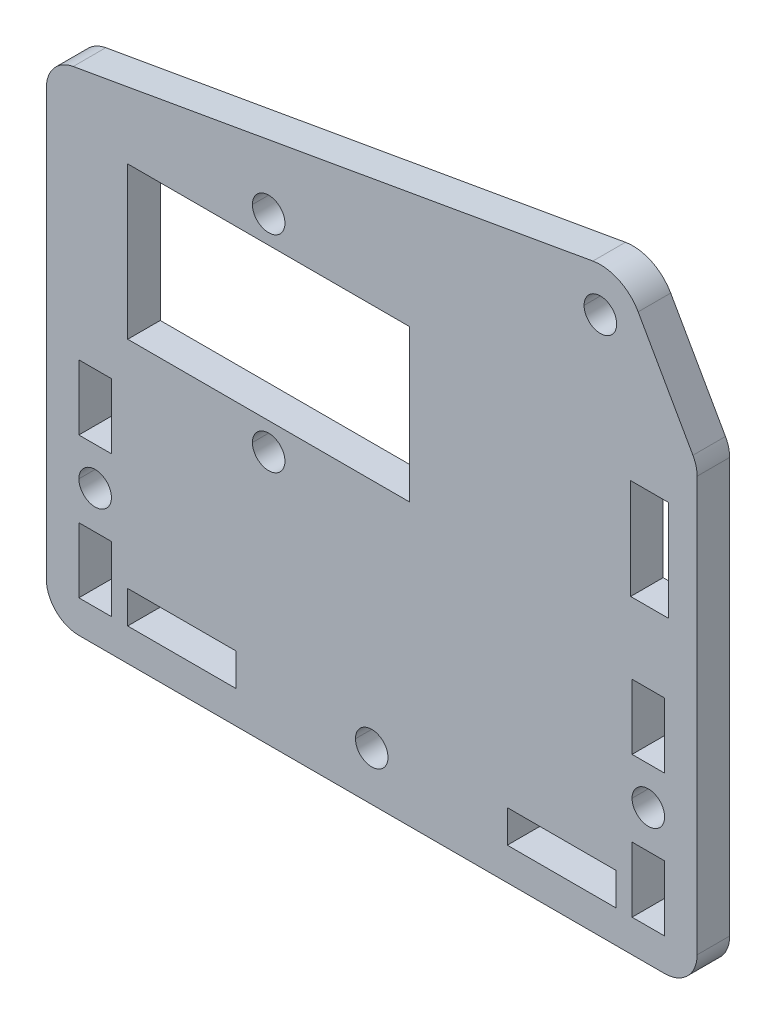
SolidWorks part; units mm, degrees
ref_plane "Front Plane" through (0, 0, 0) normal (0, 0, 1) x (1, 0, 0)
ref_plane "Top Plane" through (0, 0, 0) normal (0, 1, 0) x (1, 0, 0)
ref_plane "Right Plane" through (0, 0, 0) normal (1, 0, 0) x (0, 0, -1)
imported_body "Imported1"
sketch "Sketch1" plane through (0, 0, 0) normal (0, 0, 1) x (1, 0, 0)
  line L1 (107.63, 25.47) -> (133.63, 25.47)
  line L2 (107.63, 25.47) -> (107.63, 11.47)
  line L3 (107.63, 11.47) -> (133.63, 11.47)
  line L4 (133.63, 25.47) -> (133.63, 11.47)
  line L5 (157.4931, 14.116) -> (153.9931, 14.116)
  line L6 (157.4931, 14.116) -> (157.4931, 23.366)
  line L7 (157.4931, 23.366) -> (153.9931, 23.366)
  line L8 (153.9931, 14.116) -> (153.9931, 23.366)
extrude "Cut-Extrude1" cut sketch "Sketch1" along normal blind 3
